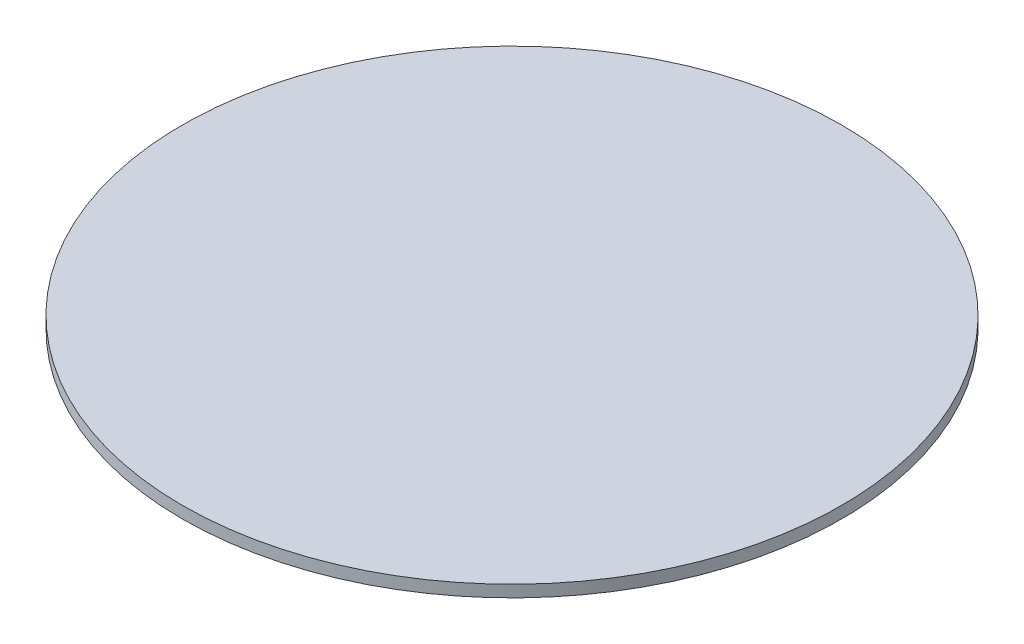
SolidWorks part; units mm, degrees
ref_plane "Front Plane" through (0, 0, 0) normal (0, 0, 1) x (1, 0, 0)
ref_plane "Top Plane" through (0, 0, 0) normal (0, 1, 0) x (1, 0, 0)
ref_plane "Right Plane" through (0, 0, 0) normal (1, 0, 0) x (0, 0, -1)
sketch "Sketch1" plane through (0, 0, 0) normal (0, 1, 0) x (1, 0, 0)
  circle A0 centre (0, 0) radius 177
  dimension "D1" = 354
extrude "Boss-Extrude1" add sketch "Sketch1" along normal blind 6.35
